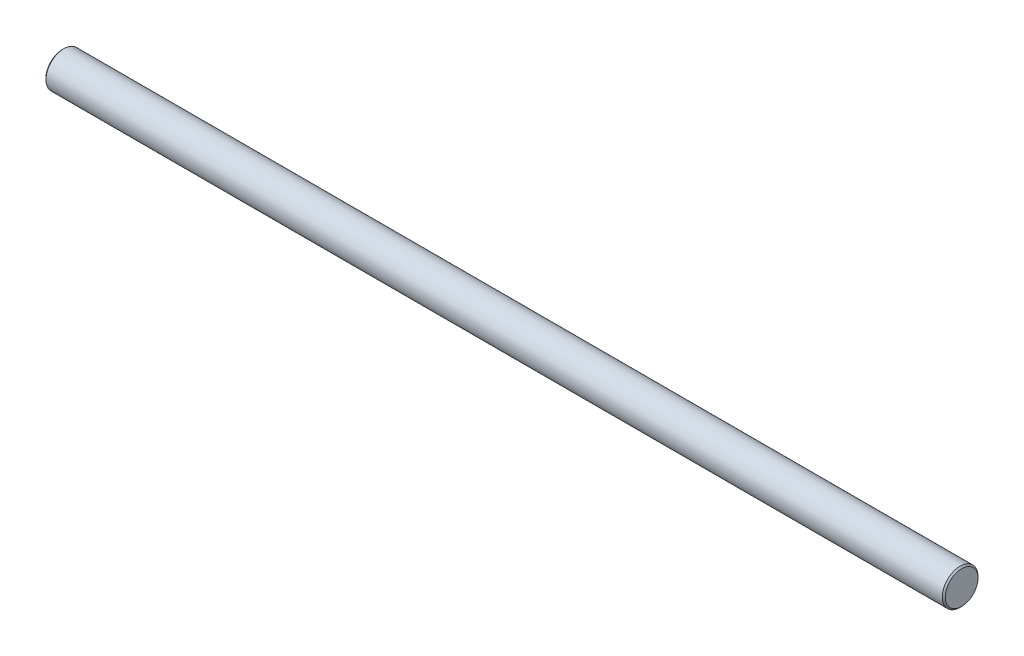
SolidWorks part; units mm, degrees
ref_plane "Спереди" through (0, 0, 0) normal (0, 0, 1) x (1, 0, 0)
ref_plane "Сверху" through (0, 0, 0) normal (0, 1, 0) x (1, 0, 0)
ref_plane "Справа" through (0, 0, 0) normal (1, 0, 0) x (0, 0, -1)
sketch "Эскиз1" plane through (0, 0, 0) normal (1, 0, 0) x (0, 0, -1)
  circle A0 centre (0, 0) radius 3
  dimension "D1" = 6
extrude "Бобышка-Вытянуть1" add sketch "Эскиз1" along normal blind 151
chamfer "Фаска1" distance 0.25 angle 45 2 edges at (0, 0, -3) (151, 0, -3)
